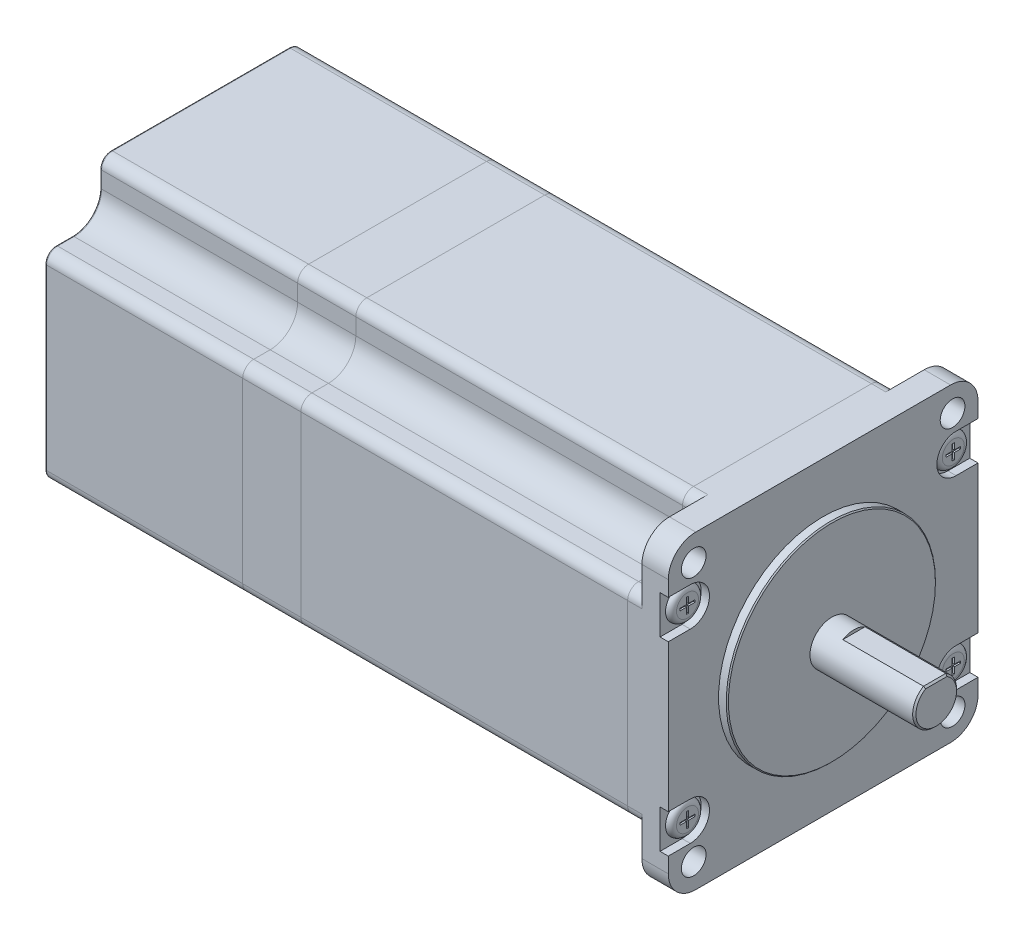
SolidWorks part; units mm, degrees
ref_plane "前视基准面" through (0, 0, 0) normal (0, 0, 1) x (1, 0, 0)
ref_plane "上视基准面" through (0, 0, 0) normal (0, 1, 0) x (1, 0, 0)
ref_plane "右视基准面" through (0, 0, 0) normal (1, 0, 0) x (0, 0, -1)
sketch "草图1" plane through (0, 0, 0) normal (1, 0, 0) x (0, 0, -1)
  line L1 (-23.2, -28.2) -> (23.2, -28.2)
  line L2 (-28.2, -23.2) -> (-28.2, 23.2)
  line L3 (-23.2, 28.2) -> (23.2, 28.2)
  line L4 (28.2, -23.2) -> (28.2, 23.2)
  line L5 (-28.2, -28.2) -> (28.2, 28.2) construction
  line L6 (-28.2, 28.2) -> (28.2, -28.2) construction
  arc A0 (-28.2, -23.2) -> (-23.2, -28.2) centre (-23.2, -23.2) ccw
  arc A1 (23.2, -28.2) -> (28.2, -23.2) centre (23.2, -23.2) ccw
  arc A2 (28.2, 23.2) -> (23.2, 28.2) centre (23.2, 23.2) ccw
  arc A3 (-28.2, 23.2) -> (-23.2, 28.2) centre (-23.2, 23.2) cw
  point P0 (0, 0)
  dimension "D1" = 5
extrude "凸台-拉伸1" add sketch "草图1" against normal blind 4.2
sketch "草图2" plane through (-4.2, 0, 0) normal (-1, 0, 0) x (0, 0, 1)
  line L0 (23.2, -18.2) -> (26.2, -18.2)
  line L1 (28.2, 23.2) -> (28.2, -23.2) construction
  line L2 (18.2, -23.2) -> (18.2, -26.2)
  line L3 (23.2, 18.2) -> (26.2, 18.2)
  line L4 (28.2, 16.2) -> (28.2, -16.2)
  line L5 (16.2, -28.2) -> (-16.2, -28.2)
  line L6 (-23.2, 28.2) -> (23.2, 28.2) construction
  line L7 (18.2, 26.2) -> (18.2, 23.2)
  line L8 (-28.2, -16.2) -> (-28.2, 16.2)
  line L9 (-18.2, 23.2) -> (-18.2, 26.2)
  line L10 (-16.2, 28.2) -> (16.2, 28.2)
  line L11 (-23.2, 18.2) -> (-26.2, 18.2)
  line L12 (-28.2, -23.2) -> (-28.2, 23.2) construction
  line L14 (-23.2, -18.2) -> (-26.2, -18.2)
  line L16 (-18.2, -23.2) -> (-18.2, -26.2)
  line L17 (23.2, -28.2) -> (-23.2, -28.2) construction
  arc A0 (18.2, 23.2) -> (23.2, 18.2) centre (23.2, 23.2) ccw
  arc A1 (-23.2, 18.2) -> (-18.2, 23.2) centre (-23.2, 23.2) ccw
  arc A2 (-18.2, -23.2) -> (-23.2, -18.2) centre (-23.2, -23.2) ccw
  arc A3 (23.2, -18.2) -> (18.2, -23.2) centre (23.2, -23.2) ccw
  arc A4 (18.2, -26.2) -> (16.2, -28.2) centre (16.2, -26.2) cw
  arc A5 (-16.2, -28.2) -> (-18.2, -26.2) centre (-16.2, -26.2) cw
  arc A6 (-26.2, -18.2) -> (-28.2, -16.2) centre (-26.2, -16.2) cw
  arc A7 (-28.2, 16.2) -> (-26.2, 18.2) centre (-26.2, 16.2) cw
  arc A8 (-18.2, 26.2) -> (-16.2, 28.2) centre (-16.2, 26.2) cw
  arc A9 (16.2, 28.2) -> (18.2, 26.2) centre (16.2, 26.2) cw
  arc A10 (26.2, 18.2) -> (28.2, 16.2) centre (26.2, 16.2) cw
  arc A11 (28.2, -16.2) -> (26.2, -18.2) centre (26.2, -16.2) cw
  point P7 (18.2, -28.2)
  point P38 (-18.2, -28.2)
  point P41 (-28.2, -18.2)
  point P44 (-28.2, 18.2)
  point P47 (-18.2, 28.2)
  point P50 (18.2, 28.2)
  point P53 (28.2, 18.2)
  point P56 (28.2, -18.2)
  dimension "D1" = 2
extrude "凸台-拉伸2" add sketch "草图2" along normal blind 3.2
sketch "草图3" plane through (-7.4, 0, 0) normal (-1, 0, 0) x (0, 0, 1)
  line L0 (28.2, -16.2) -> (28.2, 16.2)
  line L1 (23.2, 18.2) -> (26.2, 18.2)
  line L2 (-16.2, 28.2) -> (16.2, 28.2)
  line L3 (-18.2, 26.2) -> (-18.2, 23.2)
  line L4 (18.2, 26.2) -> (18.2, 23.2)
  line L5 (-23.2, 18.2) -> (-26.2, 18.2)
  line L7 (-28.2, 16.2) -> (-28.2, -16.2)
  line L9 (-26.2, -18.2) -> (-23.2, -18.2)
  line L11 (-18.2, -23.2) -> (-18.2, -26.2)
  line L13 (-16.2, -28.2) -> (16.2, -28.2)
  line L14 (18.2, -26.2) -> (18.2, -23.2)
  line L16 (23.2, -18.2) -> (26.2, -18.2)
  arc A0 (28.2, 16.2) -> (26.2, 18.2) centre (26.2, 16.2) ccw
  arc A1 (18.2, 26.2) -> (16.2, 28.2) centre (16.2, 26.2) ccw construction
  arc A2 (-26.2, 18.2) -> (-28.2, 16.2) centre (-26.2, 16.2) ccw
  arc A3 (-28.2, -16.2) -> (-26.2, -18.2) centre (-26.2, -16.2) ccw
  arc A4 (-18.2, -26.2) -> (-16.2, -28.2) centre (-16.2, -26.2) ccw
  arc A5 (16.2, -28.2) -> (18.2, -26.2) centre (16.2, -26.2) ccw
  arc A6 (26.2, -18.2) -> (28.2, -16.2) centre (26.2, -16.2) ccw
  arc A7 (23.2, -18.2) -> (18.2, -23.2) centre (23.2, -23.2) ccw
  arc A8 (-18.2, -23.2) -> (-23.2, -18.2) centre (-23.2, -23.2) ccw
  arc A9 (-23.2, 18.2) -> (-18.2, 23.2) centre (-23.2, 23.2) ccw
  arc A10 (18.2, 26.2) -> (16.2, 28.2) centre (16.2, 26.2) ccw
  arc A11 (18.2, 23.2) -> (23.2, 18.2) centre (23.2, 23.2) ccw
  arc A12 (-16.2, 28.2) -> (-18.2, 26.2) centre (-16.2, 26.2) ccw
extrude "凸台-拉伸3" add sketch "草图3" along normal blind 59.5 separate body
sketch "草图4" plane through (-66.9, 0, 0) normal (-1, 0, 0) x (0, 0, 1)
  line L0 (18.2, -23.2) -> (18.2, -26.2)
  line L3 (16.2, -28.2) -> (-16.2, -28.2)
  line L4 (-28.2, 16.2) -> (-28.2, -16.2)
  line L6 (19.6645, -19.6645) -> (-19.6645, 19.6645) construction
  line L7 (-23.2, -18.2) -> (-26.2, -18.2)
  line L8 (23.2, -18.2) -> (26.2, -18.2)
  line L9 (16.2, 28.2) -> (-16.2, 28.2)
  line L10 (23.2, 18.2) -> (26.2, 18.2)
  line L12 (18.2, 23.2) -> (18.2, 26.2)
  line L13 (-18.2, -23.2) -> (-18.2, -26.2)
  line L14 (-18.2, 23.2) -> (-18.2, 26.2)
  line L15 (19.6645, 19.6645) -> (-19.6645, -19.6645) construction
  line L16 (-23.2, 18.2) -> (-26.2, 18.2)
  line L17 (28.2, 16.2) -> (28.2, -16.2)
  arc A0 (23.2, -18.2) -> (18.2, -23.2) centre (23.2, -23.2) ccw
  arc A1 (28.2, 16.2) -> (26.2, 18.2) centre (26.2, 16.2) ccw
  arc A2 (-23.2, 18.2) -> (-18.2, 23.2) centre (-23.2, 23.2) ccw
  arc A3 (18.2, 23.2) -> (23.2, 18.2) centre (23.2, 23.2) ccw
  arc A4 (-18.2, -23.2) -> (-23.2, -18.2) centre (-23.2, -23.2) ccw
  arc A5 (18.2, 26.2) -> (16.2, 28.2) centre (16.2, 26.2) ccw
  arc A6 (-16.2, 28.2) -> (-18.2, 26.2) centre (-16.2, 26.2) ccw
  arc A7 (-26.2, 18.2) -> (-28.2, 16.2) centre (-26.2, 16.2) ccw
  arc A8 (-28.2, -16.2) -> (-26.2, -18.2) centre (-26.2, -16.2) ccw
  arc A9 (-18.2, -26.2) -> (-16.2, -28.2) centre (-16.2, -26.2) ccw
  arc A10 (18.2, -26.2) -> (16.2, -28.2) centre (16.2, -26.2) cw
  arc A11 (28.2, -16.2) -> (26.2, -18.2) centre (26.2, -16.2) cw
  point P0 (0, 0)
  dimension "D1" = 2
extrude "凸台-拉伸4" add sketch "草图4" along normal blind 10 separate body
sketch "草图5" plane through (0, 0, 0) normal (1, 0, 0) x (0, 0, -1)
  line L0 (24.2, -20.4) -> (28.2, -20.4)
  line L1 (28.2, -23.2) -> (28.2, 23.2) construction
  line L2 (28.2, -20.4) -> (28.2, -13.4)
  line L5 (28.2, -13.4) -> (24.2, -13.4)
  line L11 (24.2, 13.4) -> (28.2, 13.4)
  line L12 (28.2, 13.4) -> (28.2, 20.4)
  line L13 (28.2, 20.4) -> (24.2, 20.4)
  line L14 (-24.2, 20.4) -> (-28.2, 20.4)
  line L15 (-28.2, 23.2) -> (-28.2, -23.2) construction
  line L16 (-28.2, 20.4) -> (-28.2, 13.4)
  line L17 (-28.2, 13.4) -> (-24.2, 13.4)
  line L19 (-24.2, -13.4) -> (-28.2, -13.4)
  line L20 (-28.2, -13.4) -> (-28.2, -20.4)
  line L21 (-28.2, -20.4) -> (-24.2, -20.4)
  arc A0 (24.2, -13.4) -> (24.2, -20.4) centre (24.2, -16.9) ccw
  arc A1 (-24.2, -20.4) -> (-24.2, -13.4) centre (-24.2, -16.9) ccw
  arc A2 (-24.2, 13.4) -> (-24.2, 20.4) centre (-24.2, 16.9) ccw
  arc A3 (24.2, 20.4) -> (24.2, 13.4) centre (24.2, 16.9) ccw
extrude "切除-拉伸1" cut sketch "草图5" against normal blind 1.5
sketch "草图6" plane through (-1.5, 0, 0) normal (1, 0, 0) x (0, 0, -1)
  circle A0 centre (24.2, -16.9) radius 3
  circle A1 centre (-24.2, -16.9) radius 3
  circle A2 centre (-24.2, 16.9) radius 3
  circle A3 centre (24.2, 16.9) radius 3
extrude "凸台-拉伸5" add sketch "草图6" along normal blind 1
fillet "圆角1" radius 1 4 edges at (-0.5, 16.9, 21.2) (-0.5, 16.9, -27.2) (-0.5, -16.9, 21.2) (-0.5, -16.9, -27.2)
sketch "草图7" plane through (-0.5, 0, 0) normal (1, 0, 0) x (0, 0, -1)
  line L0 (24, -17.1) -> (24, -18.25)
  line L1 (24, -15.55) -> (24.4, -15.55)
  line L2 (24, -15.55) -> (24, -16.7)
  line L3 (24, -18.25) -> (24.4, -18.25)
  line L4 (24.4, -15.55) -> (24.4, -16.7)
  line L5 (24, 16.7) -> (24, 15.55)
  line L6 (24, 16.7) -> (22.85, 16.7)
  line L7 (25.55, -16.7) -> (24.4, -16.7)
  line L8 (25.55, -16.7) -> (25.55, -17.1)
  line L9 (25.55, -17.1) -> (24.4, -17.1)
  line L10 (22.85, -16.7) -> (22.85, -17.1)
  line L11 (24.4, 16.7) -> (24.4, 15.55)
  line L12 (24, 17.1) -> (22.85, 17.1)
  line L13 (-24.4, -15.55) -> (-24, -15.55)
  line L14 (-24.4, -15.55) -> (-24.4, -16.7)
  line L15 (-24.4, -18.25) -> (-24, -18.25)
  line L16 (-24, -15.55) -> (-24, -16.7)
  line L19 (-22.85, -16.7) -> (-24, -16.7)
  line L20 (-22.85, -16.7) -> (-22.85, -17.1)
  line L21 (-22.85, -17.1) -> (-24, -17.1)
  line L22 (-25.55, -16.7) -> (-25.55, -17.1)
  line L25 (-22.85, 17.1) -> (-24, 17.1)
  line L26 (-22.85, 17.1) -> (-22.85, 16.7)
  line L27 (-22.85, 16.7) -> (-24, 16.7)
  line L28 (-25.55, 17.1) -> (-25.55, 16.7)
  line L29 (-24.4, -17.1) -> (-24.4, -18.25)
  line L31 (-24.4, 18.25) -> (-24, 18.25)
  line L32 (-24.4, 18.25) -> (-24.4, 17.1)
  line L33 (-24.4, 15.55) -> (-24, 15.55)
  line L34 (-24, 18.25) -> (-24, 17.1)
  line L36 (-24.4, -17.1) -> (-25.55, -17.1)
  line L37 (24, 18.25) -> (24.4, 18.25)
  line L38 (24, 18.25) -> (24, 17.1)
  line L39 (24, 15.55) -> (24.4, 15.55)
  line L40 (24.4, 18.25) -> (24.4, 17.1)
  line L41 (-24.4, 16.7) -> (-24.4, 15.55)
  line L42 (-24, -17.1) -> (-24, -18.25)
  line L43 (25.55, 17.1) -> (24.4, 17.1)
  line L44 (25.55, 17.1) -> (25.55, 16.7)
  line L45 (25.55, 16.7) -> (24.4, 16.7)
  line L46 (22.85, 17.1) -> (22.85, 16.7)
  line L47 (-24.4, -16.7) -> (-25.55, -16.7)
  line L48 (-24.4, 16.7) -> (-25.55, 16.7)
  line L49 (-24, 16.7) -> (-24, 15.55)
  line L50 (-24.4, 17.1) -> (-25.55, 17.1)
  line L51 (24, -17.1) -> (22.85, -17.1)
  line L52 (24.4, -17.1) -> (24.4, -18.25)
  line L53 (24, -16.7) -> (22.85, -16.7)
  point P0 (24.2, -16.9)
  point P6 (24.2, -16.9)
  point P11 (-24.2, -16.9)
  point P17 (-24.2, -16.9)
  point P22 (-24.2, 16.9)
  point P28 (-24.2, 16.9)
  point P33 (24.2, 16.9)
  point P39 (24.2, 16.9)
extrude "切除-拉伸2" cut sketch "草图7" against normal blind 0.3
sketch "草图8" plane through (0, 0, 0) normal (1, 0, 0) x (0, 0, -1)
  circle A0 centre (23.57, -23.57) radius 2.25
  circle A1 centre (-23.57, -23.57) radius 2.25
  circle A2 centre (-23.57, 23.57) radius 2.25
  circle A3 centre (23.57, 23.57) radius 2.25
  point P0 (0, 0)
sketch "草图10" plane through (-4.2, 0, 0) normal (-1, 0, 0) x (0, 0, 1)
  line L0 (-18.2, -23.2) -> (-18.2, -26.2)
  line L1 (-16.2, -28.2) -> (-23.2, -28.2)
  line L3 (-28.2, -23.2) -> (-28.2, -16.2)
  line L5 (-26.2, -18.2) -> (-23.2, -18.2)
  line L6 (-18.2, 23.2) -> (-18.2, 26.2)
  line L8 (-16.2, 28.2) -> (-23.2, 28.2)
  line L10 (-28.2, 23.2) -> (-28.2, 16.2)
  line L12 (-26.2, 18.2) -> (-23.2, 18.2)
  line L13 (28.2, 16.2) -> (28.2, 23.2)
  line L15 (23.2, 28.2) -> (16.2, 28.2)
  line L17 (18.2, 26.2) -> (18.2, 23.2)
  line L19 (23.2, 18.2) -> (26.2, 18.2)
  line L20 (28.2, -23.2) -> (28.2, -16.2)
  line L22 (26.2, -18.2) -> (23.2, -18.2)
  line L24 (18.2, -23.2) -> (18.2, -26.2)
  line L26 (16.2, -28.2) -> (23.2, -28.2)
  arc A0 (-18.2, -23.2) -> (-23.2, -18.2) centre (-23.2, -23.2) ccw
  arc A1 (-18.2, -26.2) -> (-16.2, -28.2) centre (-16.2, -26.2) ccw
  arc A2 (-28.2, -16.2) -> (-26.2, -18.2) centre (-26.2, -16.2) ccw
  arc A3 (-23.2, 28.2) -> (-28.2, 23.2) centre (-23.2, 23.2) ccw
  arc A4 (-16.2, 28.2) -> (-18.2, 26.2) centre (-16.2, 26.2) ccw
  arc A5 (-26.2, 18.2) -> (-28.2, 16.2) centre (-26.2, 16.2) ccw
  arc A6 (28.2, 23.2) -> (23.2, 28.2) centre (23.2, 23.2) ccw
  arc A7 (18.2, 26.2) -> (16.2, 28.2) centre (16.2, 26.2) ccw
  arc A8 (28.2, 16.2) -> (26.2, 18.2) centre (26.2, 16.2) ccw
  arc A9 (23.2, -28.2) -> (28.2, -23.2) centre (23.2, -23.2) ccw
  arc A10 (26.2, -18.2) -> (28.2, -16.2) centre (26.2, -16.2) ccw
  arc A11 (16.2, -28.2) -> (18.2, -26.2) centre (16.2, -26.2) ccw
  arc A12 (23.2, -18.2) -> (18.2, -23.2) centre (23.2, -23.2) ccw
  arc A13 (18.2, 23.2) -> (23.2, 18.2) centre (23.2, 23.2) ccw
  arc A14 (-28.2, -23.2) -> (-23.2, -28.2) centre (-23.2, -23.2) ccw
  arc A15 (-23.2, 18.2) -> (-18.2, 23.2) centre (-23.2, 23.2) ccw
extrude "凸台-拉伸6" add sketch "草图10" along normal blind 0.6
extrude "切除-拉伸3" cut sketch "草图8" against normal blind 4.8
sketch "草图12" plane through (-76.9, 0, 0) normal (-1, 0, 0) x (0, 0, 1)
  line L0 (-16.2, -28.2) -> (16.2, -28.2)
  line L2 (18.2, -26.2) -> (18.2, -23.2)
  line L4 (23.2, -18.2) -> (26.2, -18.2)
  line L6 (28.2, -16.2) -> (28.2, 16.2)
  line L8 (26.2, 18.2) -> (23.2, 18.2)
  line L10 (18.2, 23.2) -> (18.2, 26.2)
  line L12 (16.2, 28.2) -> (-16.2, 28.2)
  line L14 (-18.2, 26.2) -> (-18.2, 23.2)
  line L16 (-23.2, 18.2) -> (-26.2, 18.2)
  line L18 (-28.2, 16.2) -> (-28.2, -16.2)
  line L20 (-26.2, -18.2) -> (-23.2, -18.2)
  line L22 (-18.2, -23.2) -> (-18.2, -26.2)
  arc A0 (-28.2, -16.2) -> (-26.2, -18.2) centre (-26.2, -16.2) ccw
  arc A1 (-18.2, -26.2) -> (-16.2, -28.2) centre (-16.2, -26.2) ccw
  arc A2 (-26.2, 18.2) -> (-28.2, 16.2) centre (-26.2, 16.2) ccw
  arc A3 (-16.2, 28.2) -> (-18.2, 26.2) centre (-16.2, 26.2) ccw
  arc A4 (18.2, 26.2) -> (16.2, 28.2) centre (16.2, 26.2) ccw
  arc A5 (28.2, 16.2) -> (26.2, 18.2) centre (26.2, 16.2) ccw
  arc A6 (26.2, -18.2) -> (28.2, -16.2) centre (26.2, -16.2) ccw
  arc A7 (16.2, -28.2) -> (18.2, -26.2) centre (16.2, -26.2) ccw
  arc A8 (-18.2, -23.2) -> (-23.2, -18.2) centre (-23.2, -23.2) ccw
  arc A9 (-23.2, 18.2) -> (-18.2, 23.2) centre (-23.2, 23.2) ccw
  arc A10 (18.2, 23.2) -> (23.2, 18.2) centre (23.2, 23.2) ccw
  arc A11 (23.2, -18.2) -> (18.2, -23.2) centre (23.2, -23.2) ccw
extrude "凸台-拉伸7" add sketch "草图12" along normal blind 0.6
sketch "草图14" plane through (0, 0, 0) normal (1, 0, 0) x (0, 0, -1)
  circle A0 centre (0, 0) radius 19.05
extrude "凸台-拉伸8" add sketch "草图14" along normal blind 1.6
chamfer "倒角1" distance 0.2 angle 45 1 edges at (1.6, 0, -19.05)
sketch "草图15" plane through (1.6, 0, 0) normal (1, 0, 0) x (0, 0, -1)
  circle A0 centre (0, 0) radius 4
extrude "凸台-拉伸9" add sketch "草图15" along normal blind 19
sketch "草图20" plane through (20.6, 0, 0) normal (1, 0, 0) x (0, 0, -1)
  line L2 (2.0242, 3.45) -> (-2.0242, 3.45)
  arc A0 (2.0242, 3.45) -> (-2.0242, 3.45) centre (0, 0) ccw
extrude "切除-拉伸4" cut sketch "草图20" against normal blind 15
chamfer "倒角3" distance 0.3 angle 45 2 edges at (20.6, -4, 0) (20.6, 3.45, 0)
sketch "草图25" plane through (-77.5, 0, 0) normal (-1, 0, 0) x (0, 0, 1)
  line L1 (-16.2, -28.2) -> (16.2, -28.2)
  line L3 (-16.2, 28.2) -> (16.2, 28.2)
  line L4 (28.2, -16.2) -> (28.2, 16.2)
  line L7 (-26.2, 18.2) -> (-23.2, 18.2)
  line L9 (-18.2, 23.2) -> (-18.2, 26.2)
  line L11 (18.2, 26.2) -> (18.2, 23.2)
  line L13 (23.2, 18.2) -> (26.2, 18.2)
  line L15 (26.2, -18.2) -> (23.2, -18.2)
  line L17 (18.2, -23.2) -> (18.2, -26.2)
  line L19 (-18.2, -26.2) -> (-18.2, -23.2)
  line L21 (-23.2, -18.2) -> (-26.2, -18.2)
  line L22 (-28.2, -16.2) -> (-28.2, 16.2)
  arc A0 (-23.2, 18.2) -> (-18.2, 23.2) centre (-23.2, 23.2) ccw
  arc A1 (18.2, 23.2) -> (23.2, 18.2) centre (23.2, 23.2) ccw
  arc A2 (23.2, -18.2) -> (18.2, -23.2) centre (23.2, -23.2) ccw
  arc A4 (-28.2, -16.2) -> (-26.2, -18.2) centre (-26.2, -16.2) ccw
  arc A5 (-18.2, -26.2) -> (-16.2, -28.2) centre (-16.2, -26.2) ccw
  arc A6 (16.2, -28.2) -> (18.2, -26.2) centre (16.2, -26.2) ccw
  arc A7 (26.2, -18.2) -> (28.2, -16.2) centre (26.2, -16.2) ccw
  arc A8 (28.2, 16.2) -> (26.2, 18.2) centre (26.2, 16.2) ccw
  arc A9 (18.2, 26.2) -> (16.2, 28.2) centre (16.2, 26.2) ccw
  arc A10 (-16.2, 28.2) -> (-18.2, 26.2) centre (-16.2, 26.2) ccw
  arc A11 (-26.2, 18.2) -> (-28.2, 16.2) centre (-26.2, 16.2) ccw
  arc A12 (-18.2, -23.2) -> (-23.2, -18.2) centre (-23.2, -23.2) ccw
  point P0 (0, 0)
extrude "凸台-拉伸10" add sketch "草图25" along normal blind 36 separate body
fillet "圆角2" radius 0.3 24 edges at (-113.5, 24.7, 18.2) (-113.5, 19.6645, 19.6645) (-113.5, 18.2, 24.7) (-113.5, 17.6142, 27.6142) (-113.5, 0, 28.2) (-113.5, -17.6142, 27.6142) (-113.5, -18.2, 24.7) (-113.5, -19.6645, 19.6645) (-113.5, -24.7, 18.2) (-113.5, -27.6142, 17.6142) (-113.5, -28.2, 0) (-113.5, -27.6142, -17.6142) (-113.5, -24.7, -18.2) (-113.5, -19.6645, -19.6645) (-113.5, -18.2, -24.7) (-113.5, -17.6142, -27.6142) (-113.5, 0, -28.2) (-113.5, 17.6142, -27.6142) (-113.5, 18.2, -24.7) (-113.5, 19.6645, -19.6645) (-113.5, 24.7, -18.2) (-113.5, 27.6142, -17.6142) (-113.5, 28.2, 0) (-113.5, 27.6142, 17.6142)
